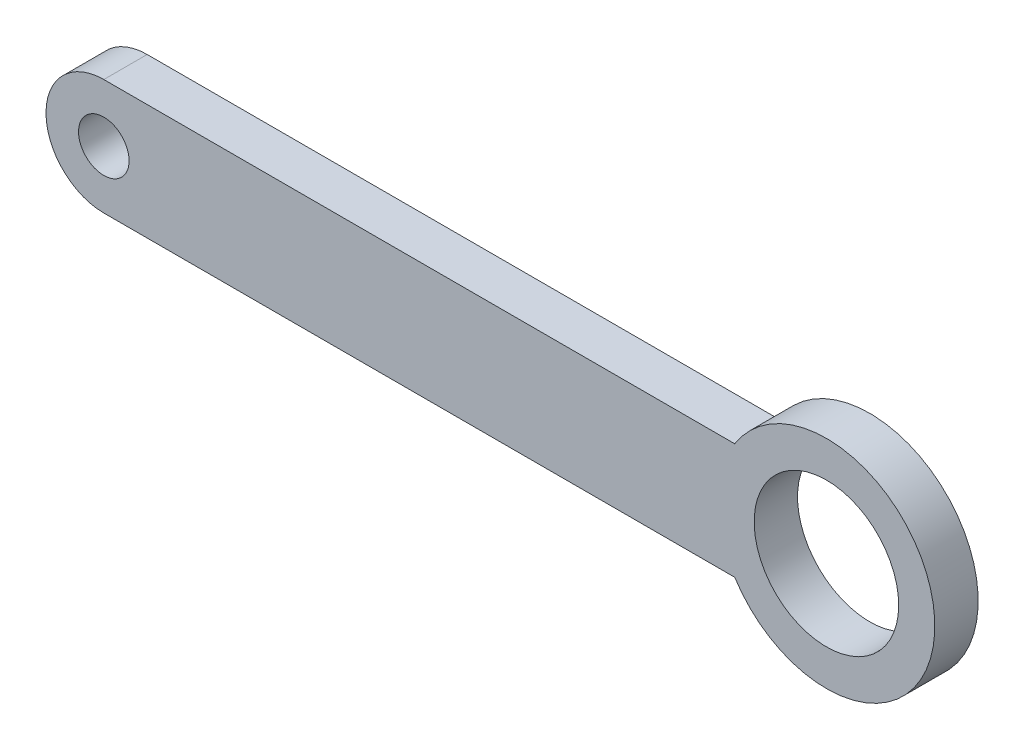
SolidWorks part; units mm, degrees
ref_plane "Plan de face" through (0, 0, 0) normal (0, 0, 1) x (1, 0, 0)
ref_plane "Plan de dessus" through (0, 0, 0) normal (0, 1, 0) x (1, 0, 0)
ref_plane "Plan de droite" through (0, 0, 0) normal (1, 0, 0) x (0, 0, -1)
sketch "Esquisse1" plane through (0, 0, 0) normal (0, 0, 1) x (1, 0, 0)
  line L0 (0, 0) -> (-50, 0)
  line L1 (-50, 4) -> (-6.3443, 4)
  line L2 (-50, -4) -> (-6.3443, -4)
  circle A0 centre (0, 0) radius 5
  arc A1 (-6.3443, -4) -> (-6.3443, 4) centre (0, 0) ccw
  circle A2 centre (-50, 0) radius 1.75
  arc A3 (-50, 4) -> (-50, -4) centre (-50, 0) ccw
  dimension "D1" = 10
  dimension "D2" = 15
  dimension "D4" = 3.5
  dimension "D5" = 8
  dimension "D3" = 50
extrude "Boss.-Extru.1" add sketch "Esquisse1" along normal blind 3
